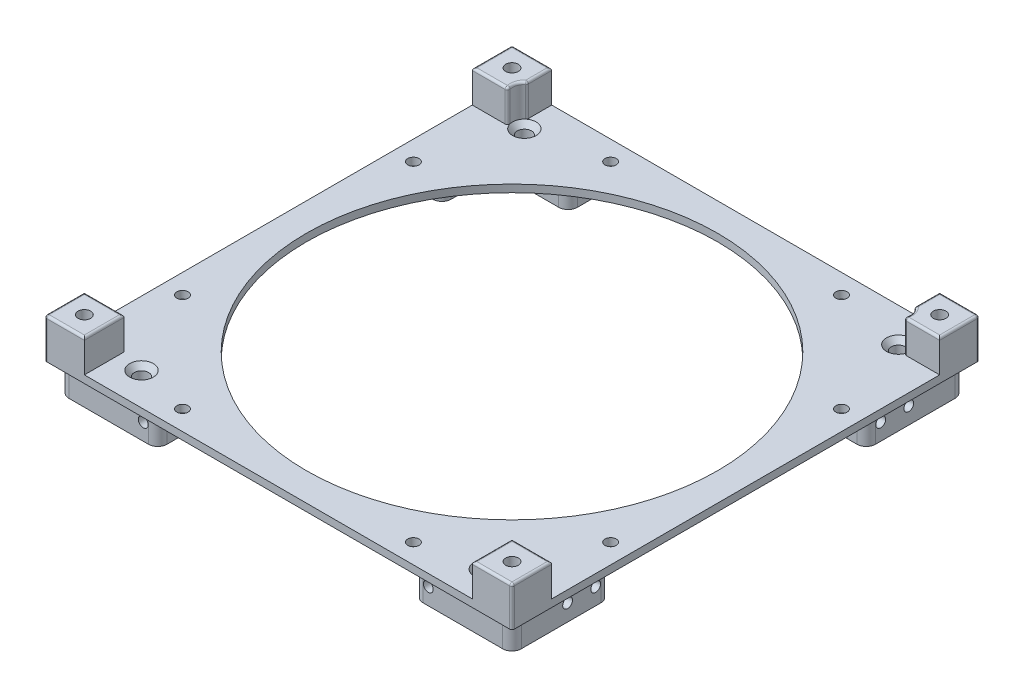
SolidWorks part; units mm, degrees
ref_plane "Front Plane" through (0, 0, 0) normal (0, 0, 1) x (1, 0, 0)
ref_plane "Top Plane" through (0, 0, 0) normal (0, 1, 0) x (1, 0, 0)
ref_plane "Right Plane" through (0, 0, 0) normal (1, 0, 0) x (0, 0, -1)
sketch "Sketch2" plane through (0, 0, 0) normal (0, 1, 0) x (1, 0, 0)
  line L1 (-50, 50) -> (50, 50)
  line L2 (-50, 50) -> (-50, -50)
  line L3 (-50, -50) -> (50, -50)
  line L4 (50, 50) -> (50, -50)
  point P4 (0, 50)
  point P6 (-50, 0)
  dimension "D1" = 100
  dimension "D2" = 100
extrude "Boss-Extrude1" add sketch "Sketch2" along normal blind 1.6
sketch "Sketch3" plane through (0, 0, 0) normal (0, 1, 0) x (1, 0, 0)
  line L1 (-50, 50) -> (-41.5, 50)
  line L2 (-50, 50) -> (-50, 41.5)
  line L3 (-50, 41.5) -> (-41.5, 41.5)
  line L4 (-41.5, 50) -> (-41.5, 41.5)
  line L5 (50, 50) -> (41.5, 50)
  line L6 (50, 50) -> (50, 41.5)
  line L7 (50, 41.5) -> (41.5, 41.5)
  line L8 (41.5, 50) -> (41.5, 41.5)
  line L9 (-50, -50) -> (-41.5, -50)
  line L10 (-50, -50) -> (-50, -41.5)
  line L11 (-50, -41.5) -> (-41.5, -41.5)
  line L12 (-41.5, -50) -> (-41.5, -41.5)
  line L13 (50, -50) -> (41.5, -50)
  line L14 (50, -50) -> (50, -41.5)
  line L15 (50, -41.5) -> (41.5, -41.5)
  line L16 (41.5, -50) -> (41.5, -41.5)
  dimension "D1" = 8.5
extrude "Boss-Extrude2" add sketch "Sketch3" along normal blind 8.5
sketch "Sketch4" plane through (0, 0, 0) normal (0, -1, 0) x (1, 0, 0)
  line L0 (27.4, 48.4) -> (48.4, 48.4)
  line L3 (45.4, 45.4) -> (27.4, 45.4)
  line L4 (27.4, 48.4) -> (27.4, 45.4)
  line L7 (48.4, 27.4) -> (45.4, 27.4)
  line L8 (45.4, 45.4) -> (45.4, 27.4)
  line L9 (48.4, 48.4) -> (48.4, 27.4)
  line L10 (50, 50) -> (50, -50) construction
  line L11 (-50, 50) -> (50, 50) construction
  line L12 (48.4, -48.4) -> (27.4, -48.4)
  line L13 (48.4, -27.4) -> (45.4, -27.4)
  line L14 (48.4, -27.4) -> (48.4, -48.4)
  line L16 (45.4, -27.4) -> (45.4, -45.4)
  line L19 (45.4, -45.4) -> (27.4, -45.4)
  line L20 (27.4, -48.4) -> (27.4, -45.4)
  line L21 (50, -50) -> (-50, -50) construction
  dimension "D1" = 21
  dimension "D2" = 3
  dimension "D3" = 1.6
  dimension "D4" = 1.6
  dimension "D5" = 1.6
extrude "Boss-Extrude3" add sketch "Sketch4" along normal blind 6
sketch "Sketch51" plane through (0, 0, 0) normal (0, 1, 0) x (1, 0, 0)
  circle A0 centre (0, 0) radius 44
  dimension "D1" = 88
extrude "Cut-Extrude1" cut sketch "Sketch51" along normal up to surface (1.6 mm away)
fillet "Fillet5" radius 0.5 4 edges at (-50, 4.25, 50) (-50, 4.25, -50) (50, 4.25, -50) (50, 4.25, 50)
mirror "Mirror1" about plane through (0, 0, 0) normal (1, 0, 0) of "Boss-Extrude3"
sketch "Sketch53" plane through (0, 0, 0) normal (0, -1, 0) x (1, 0, 0)
  line L0 (-27.4, -45.4) -> (-45.4, -45.4)
  line L18 (-27.4, -45.4) -> (-27.4, -39.4)
  line L19 (-42.4, -39.4) -> (-27.4, -39.4)
  line L35 (-45.4, -45.4) -> (-45.4, -27.4)
  line L36 (-42.4, 39.4) -> (-27.4, 39.4)
  line L37 (-42.4, -39.4) -> (-42.4, -27.4)
  line L38 (-45.4, -27.4) -> (-42.4, -27.4)
  line L40 (-27.4, 39.4) -> (-27.4, 45.4)
  line L45 (42.4, 39.4) -> (27.4, 39.4)
  line L48 (42.4, -39.4) -> (42.4, -27.4)
  line L51 (27.4, 39.4) -> (27.4, 45.4)
  line L57 (42.4, 39.4) -> (42.4, 27.4)
  line L65 (-45.4, 27.4) -> (-42.4, 27.4)
  line L66 (-42.4, 39.4) -> (-42.4, 27.4)
  line L67 (-27.4, 45.4) -> (-45.4, 45.4)
  line L68 (27.4, -45.4) -> (27.4, -39.4)
  line L70 (27.4, -39.4) -> (42.4, -39.4)
  line L71 (-45.4, 45.4) -> (-45.4, 27.4)
  line L76 (27.4, 45.4) -> (45.4, 45.4)
  line L77 (45.4, 45.4) -> (45.4, 27.4)
  line L78 (45.4, 27.4) -> (42.4, 27.4)
  line L81 (42.4, -27.4) -> (45.4, -27.4)
  line L82 (45.4, -27.4) -> (45.4, -45.4)
  line L83 (45.4, -45.4) -> (27.4, -45.4)
  dimension "D1" = 6
  dimension "D3" = 3
  dimension "D4" = 3
extrude "Boss-Extrude4" add sketch "Sketch53" along normal up to surface (6 mm away)
fillet "Fillet4" radius 2 20 edges at (-48.4, -3, 27.4) (-48.4, -3, -27.4) (48.4, -3, 27.4) (48.4, -3, -27.4) (27.4, -3, -48.4) (27.4, -3, 48.4) (-27.4, -3, 48.4) (-27.4, -3, -48.4) (42.4, -3, -27.4) (42.4, -3, 27.4) (-42.4, -3, 27.4) (-42.4, -3, -27.4) (27.4, -3, 39.4) (27.4, -3, -39.4) (-27.4, -3, -39.4) (-27.4, -3, 39.4) (-48.4, -3, -48.4) (-48.4, -3, 48.4) (48.4, -3, 48.4) (48.4, -3, -48.4)
sketch "Sketch52" plane through (0, 0, 0) normal (0, 1, 0) x (1, 0, 0)
  line L0 (48.4, -29.4) -> (48.4, -46.4) construction
  line L2 (48.4, -29.4) -> (48.4, -46.4) construction
  line L3 (46.4, -48.4) -> (29.4, -48.4) construction
  line L4 (48.4, 46.4) -> (48.4, 29.4) construction
  line L5 (48.4, 46.4) -> (48.4, 29.4) construction
  point P0 (39.975, 42.685)
  point P1 (-40.035, 42.685)
  point P2 (-36.225, -43.045)
  point P3 (37.435, -43.045)
hole_wizard "CSK for #3 Flat Head Machine Screw1" positions "Sketch59" profile "Sketch60" countersink size "#3" standard "ANSI Inch"
sketch "Sketch59" plane through (0, 1.6, 0) normal (0, 1, 0) x (1, 0, 0)
  point P19 (37.435, -43.045)
  point P24 (-40.035, 42.685)
  point P27 (39.975, 42.685)
  point P31 (-36.225, -43.045)
sketch "Sketch60" plane through (37.435, 1.6, 43.045) normal (1, 0, 0) x (0, 0, 1)
  line L0 (0, 0) -> (0, 8.5157)
  line L1 (0, 8.5157) -> (1.524, 7.6)
  line L2 (1.524, 7.6) -> (1.524, 1.1542)
  line L3 (1.524, 1.1542) -> (2.5273, 0)
  line L5 (2.5273, 0) -> (0, 0)
  line L6 (-1.524, 1.1542) -> (-2.5273, 0) construction
  line L10 (0, 8.5157) -> (-1.524, 7.6) construction
  line L11 (0, -6.35) -> (0, 107.95) construction
  dimension "Hole Dia." = 3.048
  dimension "Hole Depth" = 7.6
  dimension "Near C'Sink Dia." = 5.0546
  dimension "Near C'Sink Angle" = 82
  dimension "Drill Angle" = 118
sketch "Sketch61" plane through (0, 1.6, 0) normal (0, 1, 0) x (1, 0, 0)
  circle A0 centre (39.975, 42.685) radius 2.5273
  circle A1 centre (-40.035, 42.685) radius 2.5273
  arc A2 (41.5, 44.7003) -> (42.2073, 41.5) centre (39.975, 42.685) ccw construction
  arc A3 (-42.2673, 41.5) -> (-41.5, 44.7444) centre (-40.035, 42.685) ccw construction
extrude "Cut-Extrude2" cut sketch "Sketch61" along normal up to surface (6.9 mm away)
sketch "side-mounting-1-holes" plane through (0, 0, 0) normal (1, 0, 0) x (0, 0, -1)
  line L0 (-49.5, 0) -> (49.5, 0) construction
  line L1 (50, 8.5) -> (50, 0) construction
  point P0 (36.5, -2.45)
  point P1 (30.5, -2.45)
  dimension "D1" = 2.45
  dimension "D2" = 13.5
  dimension "D3" = 19.5
hole_wizard "Helicoil insert1" positions "Sketch48" profile "Sketch50" hole size "M2.2x0.45" standard "ANSI Metric"
sketch "Sketch48" plane through (48.4, 0, 0) normal (1, 0, 0) x (0, 0, -1)
  point P0 (36.5, -2.45)
  point P3 (30.5, -2.45)
sketch "Sketch50" plane through (48.4, -2.45, -36.5) normal (0, 1, 0) x (0, 0, -1)
  line L0 (0, 0) -> (0, 6)
  line L1 (0, 6) -> (1.05, 6)
  line L2 (1.05, 6) -> (1.05, 0)
  line L5 (1.05, 0) -> (0, 0)
  line L11 (0, -6.35) -> (0, 107.95) construction
  dimension "Thru Hole Dia." = 2.1
  dimension "Thru Hole Depth" = 6
sketch "side-mounting-2-holes" plane through (0, 0, 0) normal (0, 0, 1) x (1, 0, 0)
  line L0 (50, 8.5) -> (50, 0) construction
  line L3 (49.5, 0) -> (-49.5, 0) construction
  point P1 (30.5, -2.4475)
  dimension "D1" = 2.4475
  dimension "D2" = 19.5
hole_wizard "Helicoil insert2" positions "Sketch44" profile "Sketch46" hole size "M2.2x0.45" standard "ANSI Metric"
sketch "Sketch44" plane through (0, 0, -48.4) normal (0, 0, -1) x (-1, 0, 0)
  point P0 (-30.5, -2.4475)
sketch "Sketch46" plane through (30.5, -2.4475, -48.4) normal (1, 0, 0) x (0, 1, 0)
  line L0 (0, 0) -> (0, 9)
  line L1 (0, 9) -> (1.05, 9)
  line L2 (1.05, 9) -> (1.05, 0)
  line L5 (1.05, 0) -> (0, 0)
  line L11 (0, -6.35) -> (0, 107.95) construction
  dimension "Thru Hole Dia." = 2.1
  dimension "Thru Hole Depth" = 9
mirror "Mirror4" about plane through (0, 0, 0) normal (1, 0, 0) of "Helicoil insert2", "Helicoil insert1"
mirror "Mirror5" about plane through (0, 0, 0) normal (0, 0, 1) of "Mirror4", "Helicoil insert1", "Helicoil insert2"
sketch "top-bottom-mounting-holes" plane through (0, 0, 0) normal (0, -1, 0) x (1, 0, 0)
  line L0 (-50, -49.5) -> (-50, 49.5) construction
  line L1 (49.5, -50) -> (-49.5, -50) construction
  point P0 (-45.8, -24.7)
  point P1 (-24.7, -45.8)
  dimension "D1" = 4.2
  dimension "D2" = 4.2
  dimension "D3" = 25.3
  dimension "D4" = 25.3
hole_wizard "M2 Clearance Hole1" positions "Sketch57" profile "Sketch58" hole size "M2" standard "ANSI Metric"
sketch "Sketch57" plane through (0, 1.6, 0) normal (0, 1, 0) x (1, 0, 0)
  point P0 (-45.8, 24.7)
  point P3 (-24.7, 45.8)
sketch "Sketch58" plane through (-45.8, 1.6, -24.7) normal (1, 0, 0) x (0, 0, 1)
  line L0 (0, 0) -> (0, 1.6)
  line L1 (0, 1.6) -> (1.2, 1.6)
  line L2 (1.2, 1.6) -> (1.2, 0)
  line L5 (1.2, 0) -> (0, 0)
  line L11 (0, -6.35) -> (0, 107.95) construction
  dimension "Thru Hole Dia." = 2.4
  dimension "Thru Hole Depth" = 1.6
mirror "Mirror6" about plane through (0, 0, 0) normal (1, 0, 0) of "M2 Clearance Hole1"
mirror "Mirror7" about plane through (0, 0, 0) normal (0, 0, 1) of "Mirror6", "M2 Clearance Hole1"
fillet "Fillet6" radius 3.2 4 edges at (-42.4, -3, 39.4) (42.4, -3, 39.4) (42.4, -3, -39.4) (-42.4, -3, -39.4)
fillet "Fillet7" radius 0.5 26 edges at (41.5, 8.5, -47.3502) (45.5, 8.5, -50) (49.8536, 8.5, -49.8536) (50, 8.5, -45.5) (46.1036, 8.5, -41.5) (42.4428, 8.5, -43.2304) (-50, 8.5, -45.5) (-49.8536, 8.5, -49.8536) (-45.5, 8.5, -50) (-41.5, 8.5, -47.3722) (-42.4945, 8.5, -43.2666) (-46.1336, 8.5, -41.5) (-45.75, 8.5, 41.5) (-41.5, 8.5, 45.75) (-45.5, 8.5, 50) (-49.8536, 8.5, 49.8536) (-50, 8.5, 45.5) (41.5, 8.5, 45.75) (45.75, 8.5, 41.5) (50, 8.5, 45.5) (49.8536, 8.5, 49.8536) (45.5, 8.5, 50) (-41.5, 5.05, -44.7444) (-42.2673, 5.05, -41.5) (42.2073, 5.05, -41.5) (41.5, 5.05, -44.7003)
sketch "Sketch62" plane through (0, 8.5, 0) normal (0, 1, 0) x (1, 0, 0)
  line L0 (42, -49.5) -> (49.5, -49.5) construction
  line L1 (42, -42) -> (42, -49.5) construction
  line L2 (-49.5, 49.5) -> (-49.5, 42) construction
  line L3 (-42, 49.5) -> (-49.5, 49.5) construction
  point P0 (45.75, -45.75)
  point P4 (45.75, -49.5)
  point P7 (42, -45.75)
  point P8 (-45.75, 45.75)
  point P10 (-49.5, 45.75)
  point P13 (-45.75, 49.5)
  point P14 (45.75, 45.75)
  point P15 (-45.75, -45.75)
hole_wizard "Tap Drill for #6-32 Tap2" positions "Sketch65" profile "Sketch66" hole size "#6-32" standard "ANSI Inch"
sketch "Sketch65" plane through (0, 8.5, 0) normal (0, 1, 0) x (1, 0, 0)
  point P0 (45.75, 45.75)
  point P3 (-45.75, -45.75)
  point P6 (-45.75, 45.75)
  point P9 (45.75, -45.75)
sketch "Sketch66" plane through (45.75, 8.5, -45.75) normal (1, 0, 0) x (0, 0, 1)
  line L0 (0, 0) -> (0, 15.3117)
  line L1 (0, 15.3117) -> (1.3525, 14.499)
  line L2 (1.3525, 14.499) -> (1.3525, 0)
  line L5 (1.3525, 0) -> (0, 0)
  line L10 (0, 15.3117) -> (-1.3526, 14.499) construction
  line L11 (0, -6.35) -> (0, 107.95) construction
  dimension "Hole Dia." = 2.7051
  dimension "Hole Depth" = 14.499
  dimension "Drill Angle" = 118
equation "\"D1@Sketch52\"=7.65+3.315"
equation "\"D2@Sketch52\"=\"D1@Sketch52\"+73.66"
equation "\"D3@Sketch52\"=0.665+4.69"
equation "\"D4@Sketch52\"=\"D3@Sketch52\"+85.73"
equation "\"D5@Sketch52\"=5.11+3.315"
equation "\"D6@Sketch52\"=\"D5@Sketch52\"+80.01"
